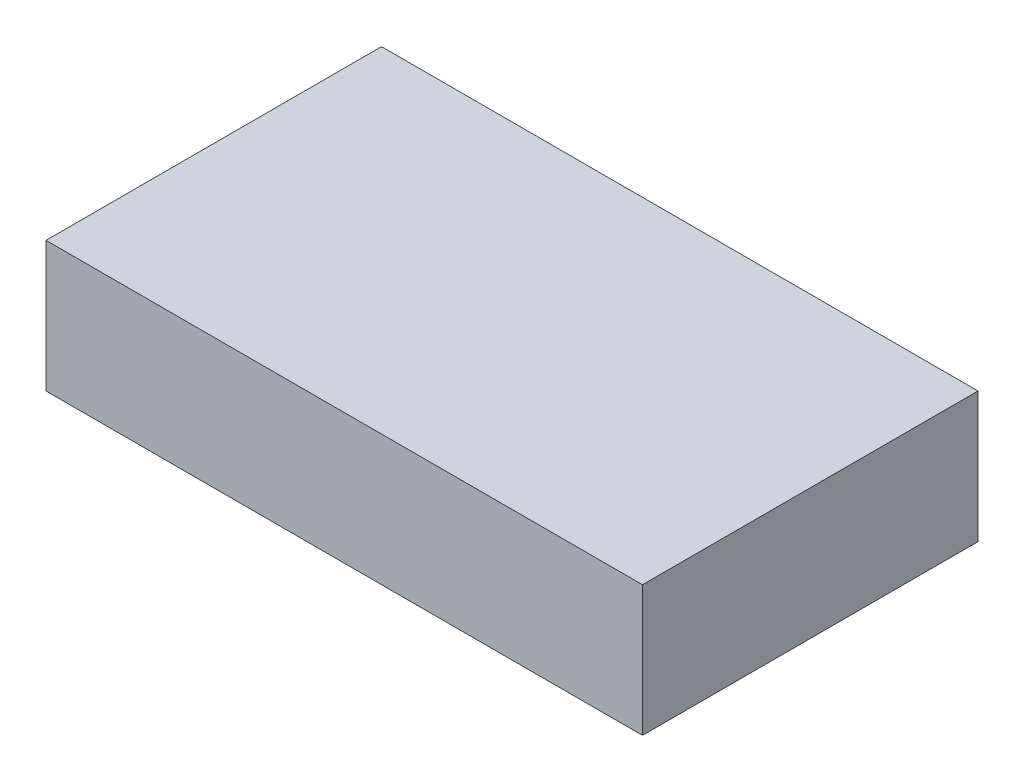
SolidWorks part; units mm, degrees
ref_plane "Front Plane" through (0, 0, 0) normal (0, 0, 1) x (1, 0, 0)
ref_plane "Top Plane" through (0, 0, 0) normal (0, 1, 0) x (1, 0, 0)
ref_plane "Right Plane" through (0, 0, 0) normal (1, 0, 0) x (0, 0, -1)
sketch "Sketch1" plane through (0, 0, 0) normal (0, 1, 0) x (1, 0, 0)
  line L1 (-16, -9) -> (16, -9)
  line L2 (-16, -9) -> (-16, 9)
  line L3 (-16, 9) -> (16, 9)
  line L4 (16, -9) -> (16, 9)
  line L5 (-16, -9) -> (16, 9) construction
  line L6 (-16, 9) -> (16, -9) construction
  point P0 (0, 0)
  dimension "D1" = 32
  dimension "D2" = 18
extrude "Boss-Extrude1" add sketch "Sketch1" along normal blind 7
